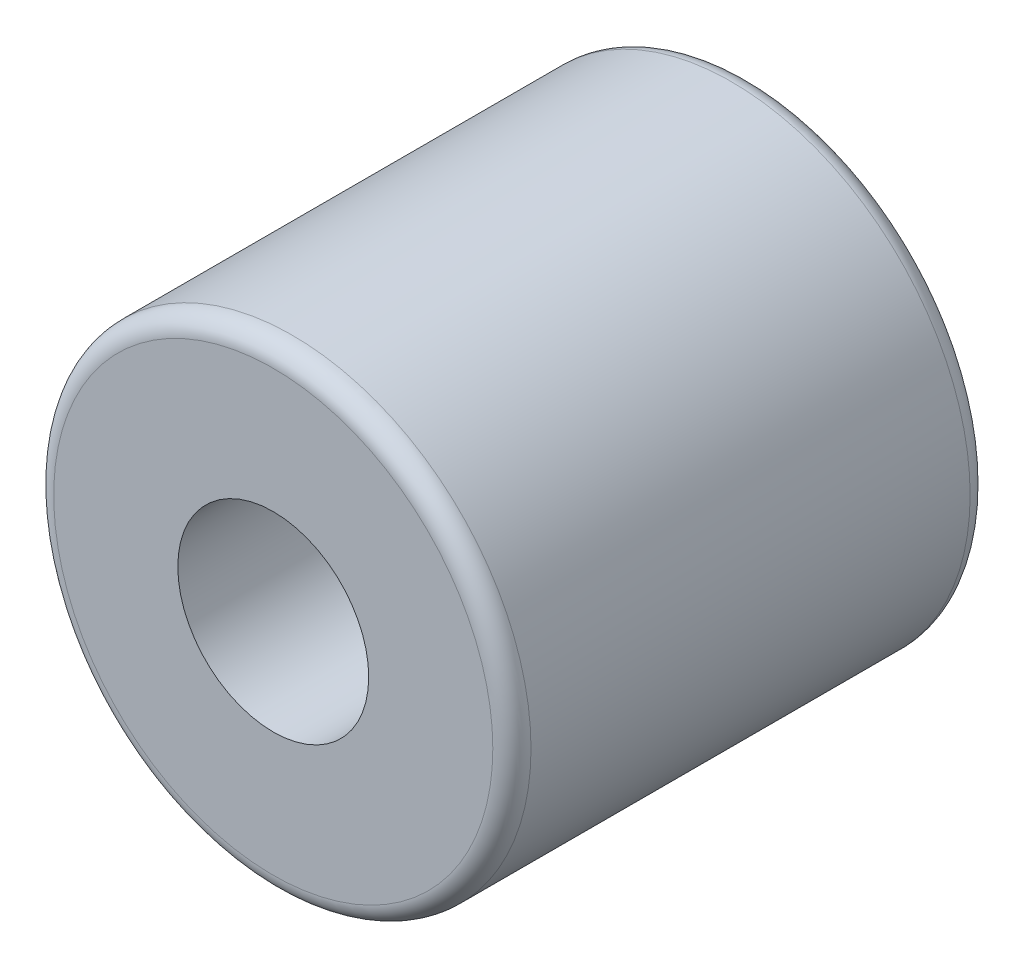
SolidWorks part; units mm, degrees
other "Camera1" [suppressed]
ref_plane "Front Plane" through (0, 0, 0) normal (0, 0, 1) x (1, 0, 0)
ref_plane "Top Plane" through (0, 0, 0) normal (0, 1, 0) x (1, 0, 0)
ref_plane "Right Plane" through (0, 0, 0) normal (1, 0, 0) x (0, 0, -1)
sketch "Sketch1" plane through (0, 0, 0) normal (0, 0, 1) x (1, 0, 0)
  circle A0 centre (0, 0) radius 12.7
  circle A1 centre (0, 0) radius 31.75
  dimension "D1" = 25.4
  dimension "D2" = 63.5
extrude "Boss-Extrude1" add sketch "Sketch1" along normal blind 63.5
fillet "Fillet1" radius 2.54 2 edges at (31.75, 0, 0) (31.75, 0, 63.5)
